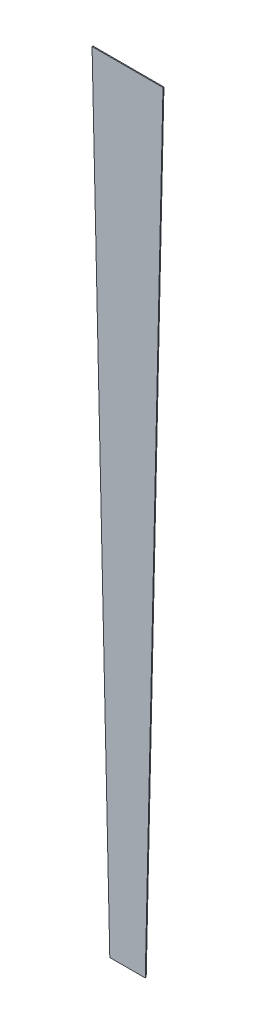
SolidWorks part; units mm, degrees
ref_plane "Front Plane" through (0, 0, 0) normal (0, 0, 1) x (1, 0, 0)
ref_plane "Top Plane" through (0, 0, 0) normal (0, 1, 0) x (1, 0, 0)
ref_plane "Right Plane" through (0, 0, 0) normal (1, 0, 0) x (0, 0, -1)
sketch "Sketch1" plane through (0, 0, 0) normal (0, 0, 1) x (1, 0, 0)
  line L0 (0, 0) -> (38.1, 0)
  line L1 (38.1, 0) -> (19.05, -838.2)
  line L2 (19.05, -838.2) -> (-19.05, -838.2)
  line L3 (-19.05, -838.2) -> (-38.1, 0)
  line L4 (-38.1, 0) -> (0, 0)
  line L5 (0, 0) -> (0, -45.9335) construction
  dimension "D1" = 38.1
  dimension "D2" = 76.2
  dimension "D3" = 838.2
extrude "Boss-Extrude1" add sketch "Sketch1" along normal blind 1.016
